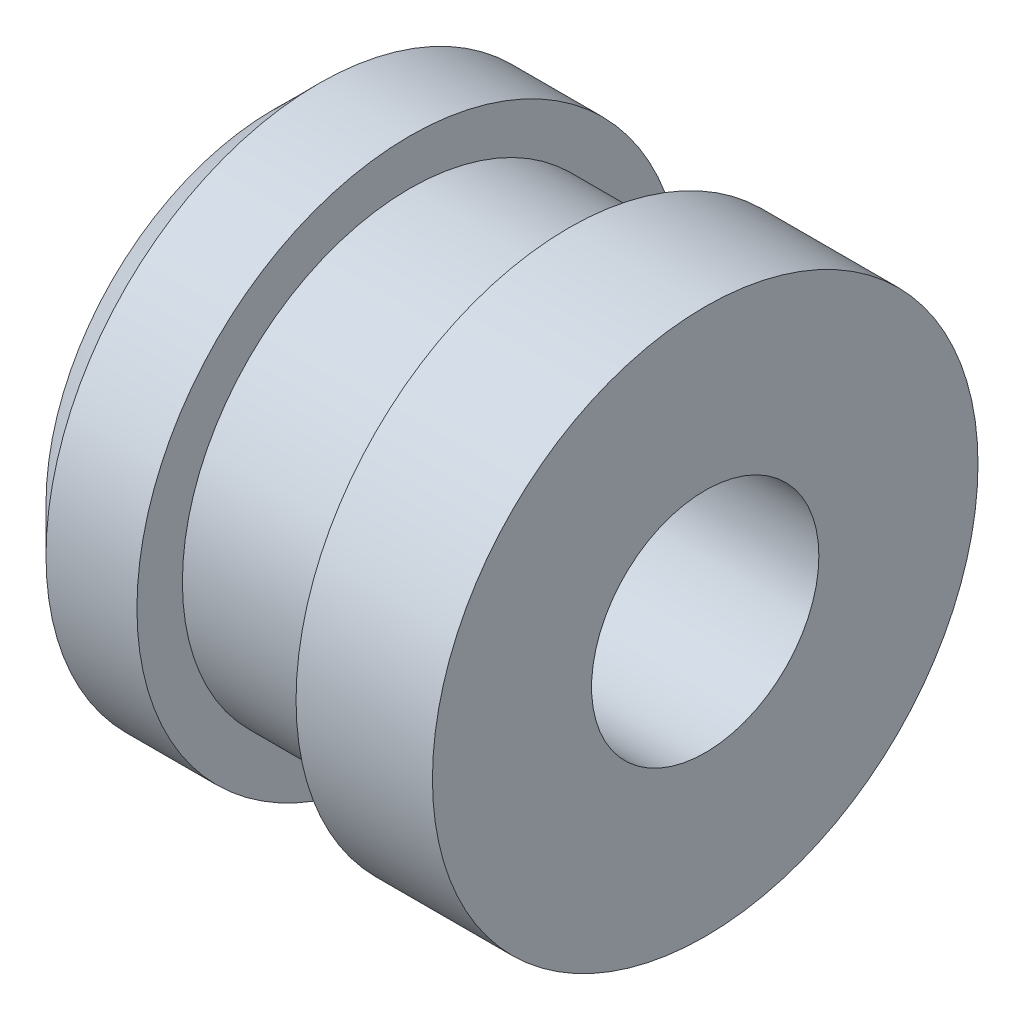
SolidWorks part; units mm, degrees
ref_plane "Front" through (0, 0, 0) normal (0, 0, 1) x (1, 0, 0)
ref_plane "Top" through (0, 0, 0) normal (0, 1, 0) x (1, 0, 0)
ref_plane "Right" through (0, 0, 0) normal (1, 0, 0) x (0, 0, -1)
sketch "Sketch1" plane through (0, 0, 0) normal (0, 1, 0) x (1, 0, 0)
  line L0 (0, 0) -> (9.5, 0)
  line L1 (9.5, 0) -> (9.5, 6)
  line L2 (9.5, 6) -> (6.5, 6)
  line L3 (6.5, 6) -> (6.5, 5)
  line L4 (6.5, 5) -> (3, 5)
  line L5 (3, 5) -> (3, 6)
  line L6 (3, 6) -> (0, 6)
  line L7 (0, 6) -> (0, 0)
revolve "Revolve1" add sketch "Sketch1" angle 360 about L0
chamfer "Chamfer1" distance 1 angle 45 1 edges at (0, 0, 6)
sketch "Sketch2" plane through (9.5, 0, 0) normal (1, 0, 0) x (0, 0, -1)
  circle A0 centre (0, 0) radius 2.5
extrude "Cut-Extrude1" cut sketch "Sketch2" against normal blind 8
